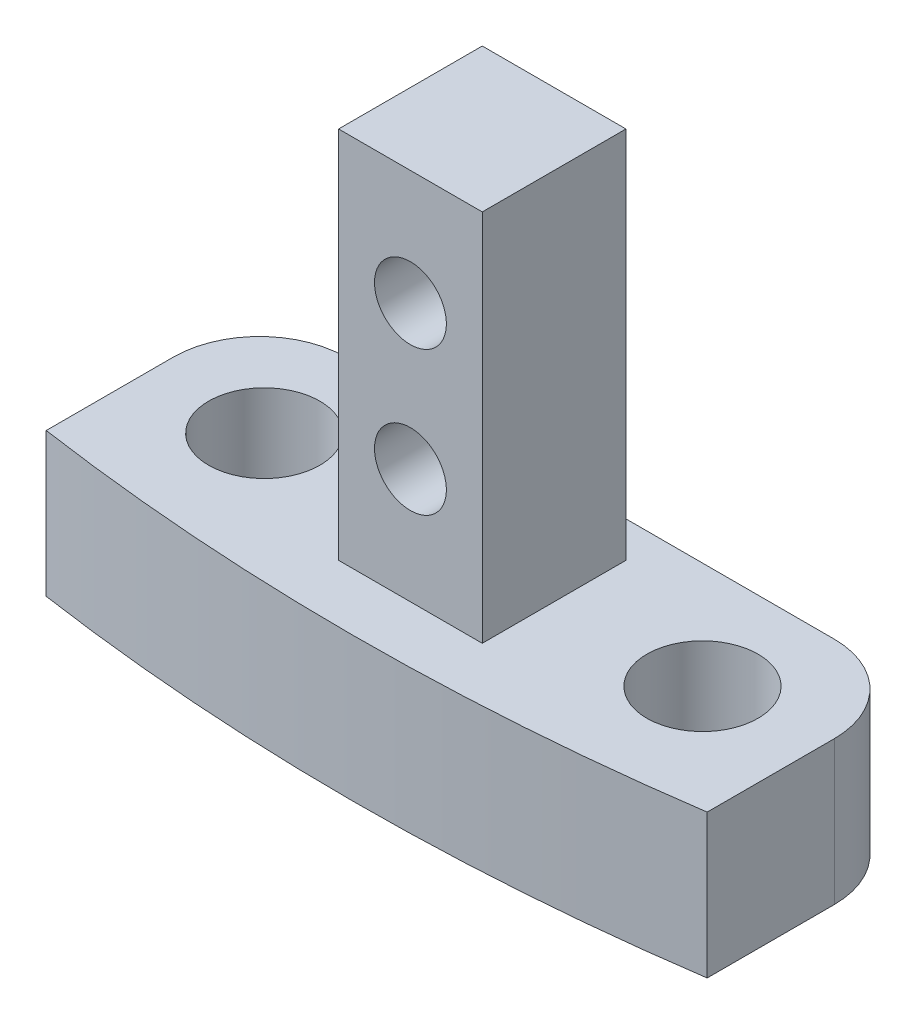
SolidWorks part; units mm, degrees
ref_plane "Front Plane" through (0, 0, 0) normal (0, 0, 1) x (1, 0, 0)
ref_plane "Top Plane" through (0, 0, 0) normal (0, 1, 0) x (1, 0, 0)
ref_plane "Right Plane" through (0, 0, 0) normal (1, 0, 0) x (0, 0, -1)
sketch "Sketch1" plane through (0, 0, 0) normal (0, 1, 0) x (1, 0, 0)
  line L0 (0, 79.1345) -> (-14.605, -20.7814) construction
  line L1 (0, 79.1345) -> (14.605, -20.7814) construction
  line L2 (0, 79.1345) -> (0, -21.8432) construction
  line L3 (-14.605, -20.7814) -> (-14.605, -11.353)
  line L4 (-14.605, -11.353) -> (14.605, -11.353)
  line L5 (14.605, -11.353) -> (14.605, -20.7814)
  line L6 (4.7625, -11.353) -> (-4.7625, -11.353) construction
  arc A0 (14.605, -20.7814) -> (-14.605, -20.7814) centre (0, 79.1345) cw
  circle A1 centre (0, 79.1345) radius 101.2317 construction
  dimension "D1" = 0.254
  dimension "D2" = 29.21
extrude "Boss-Extrude1" add sketch "Sketch1" along normal blind 6.35
sketch "Sketch2" plane through (0, 6.35, 0) normal (0, 1, 0) x (1, 0, 0)
  line L0 (14.605, -11.353) -> (-14.605, -11.353) construction
  line L1 (-3.175, -19.2905) -> (3.175, -19.2905)
  line L2 (-3.175, -19.2905) -> (-3.175, -12.9405)
  line L3 (-3.175, -12.9405) -> (3.175, -12.9405)
  line L4 (3.175, -19.2905) -> (3.175, -12.9405)
  line L5 (-3.175, -19.2905) -> (3.175, -12.9405) construction
  line L6 (-3.175, -12.9405) -> (3.175, -19.2905) construction
  point P0 (0, -16.1155)
  dimension "D1" = 6.35
  dimension "D2" = 6.35
  dimension "D3" = 1.5875
extrude "Boss-Extrude2" add sketch "Sketch2" along normal blind 16.51
hole_wizard "#10 (0.1935) Diameter Hole1" positions "Sketch4" profile "Sketch3" hole size "#10" standard "ANSI Inch"
sketch "Sketch4" plane through (0, 6.35, 0) normal (0, 1, 0) x (1, 0, 0)
  line L2 (0, -11.353) -> (0, -21.8432) construction
  line L3 (14.605, -11.353) -> (-14.605, -11.353) construction
  line L4 (4.7625, -16.0672) -> (14.605, -16.0672) construction
  line L5 (14.605, -20.7814) -> (14.605, -11.353) construction
  line L6 (3.175, -19.2905) -> (3.175, -12.9405) construction
  arc A0 (-14.605, -20.7814) -> (14.605, -20.7814) centre (0, 79.1345) ccw construction
  point P0 (9.6838, -16.0672)
  point P2 (-9.6838, -16.0672)
  dimension "D1" = 1.5875
sketch "Sketch3" plane through (9.6838, 6.35, 16.0672) normal (1, 0, 0) x (0, 0, 1)
  line L0 (0, 0) -> (0, 6.35)
  line L1 (0, 6.35) -> (2.4574, 6.35)
  line L2 (2.4574, 6.35) -> (2.4574, 0)
  line L5 (2.4574, 0) -> (0, 0)
  line L11 (0, -6.35) -> (0, 107.95) construction
  dimension "Thru Hole Dia." = 4.9149
  dimension "Thru Hole Depth" = 6.35
hole_wizard "1/8 (0.125) Diameter Hole1" positions "Sketch6" profile "Sketch5" hole size "1/8" standard "ANSI Inch"
sketch "Sketch6" plane through (0, 0, 12.9405) normal (0, 0, -1) x (-1, 0, 0)
  line L4 (0, 17.78) -> (0, 11.43) construction
  line L5 (-3.175, 14.605) -> (0, 14.605) construction
  line L6 (-3.175, 22.86) -> (-3.175, 6.35) construction
  point P0 (0, 17.78)
  point P2 (0, 11.43)
  dimension "D1" = 6.35
sketch "Sketch5" plane through (0, 17.78, 12.9405) normal (1, 0, 0) x (0, 1, 0)
  line L0 (0, 0) -> (0, 8.9027)
  line L1 (0, 8.9027) -> (1.5875, 8.9027)
  line L2 (1.5875, 8.9027) -> (1.5875, 0)
  line L5 (1.5875, 0) -> (0, 0)
  line L11 (0, -6.35) -> (0, 107.95) construction
  dimension "Thru Hole Dia." = 3.175
  dimension "Thru Hole Depth" = 8.9027
fillet "Fillet1" radius 3.81 2 edges at (-14.605, 3.175, 11.353) (14.605, 3.175, 11.353)
